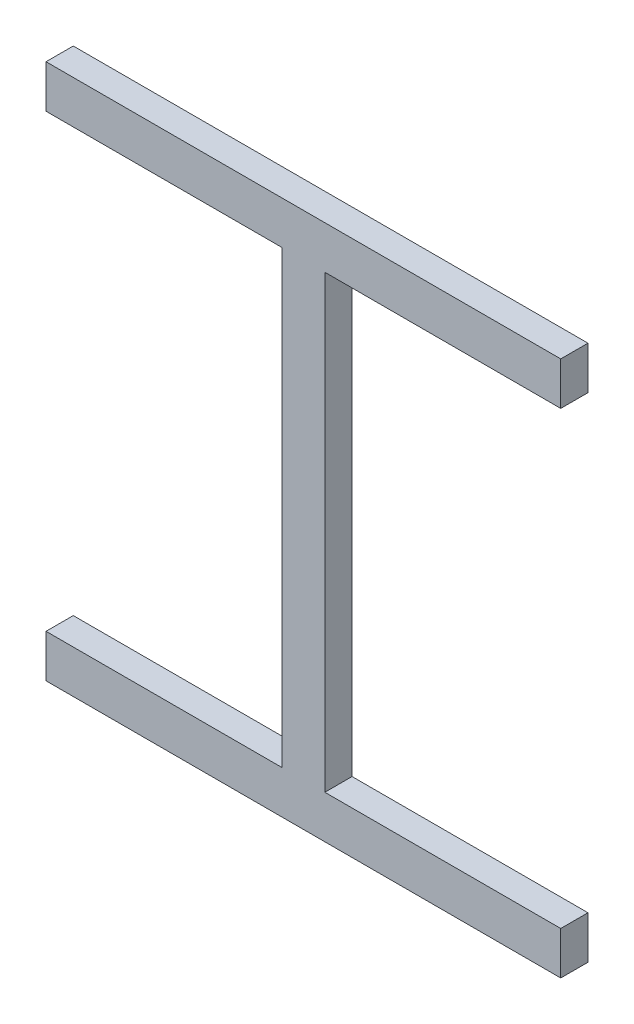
SolidWorks part; units mm, degrees
ref_plane "Front Plane" through (0, 0, 0) normal (0, 0, 1) x (1, 0, 0)
ref_plane "Top Plane" through (0, 0, 0) normal (0, 1, 0) x (1, 0, 0)
ref_plane "Right Plane" through (0, 0, 0) normal (1, 0, 0) x (0, 0, -1)
other "Configuration Table"
sketch "Sketch1" plane through (0, 0, 0) normal (0, 0, 1) x (1, 0, 0)
  line L0 (-240, -210) -> (-240, -250)
  line L1 (-240, 250) -> (240, 250)
  line L2 (-240, 250) -> (-240, 210)
  line L3 (-240, -250) -> (240, -250)
  line L4 (0, 250) -> (0, -250) construction
  line L5 (-240, 210) -> (-20, 210)
  line L6 (240, -210) -> (240, -250)
  line L7 (-240, -210) -> (-20, -210)
  line L8 (-20, 210) -> (-20, -210)
  line L9 (240, -210) -> (20, -210)
  line L10 (20, 210) -> (20, -210)
  line L11 (240, 210) -> (20, 210)
  line L12 (240, 250) -> (240, 210)
  dimension "Width" = 480
  dimension "Depth" = 500
  dimension "Web_thickness" = 40
  dimension "Thickness" = 40
extrude "BaseSection" add sketch "Sketch1" along normal mid plane 25.4
